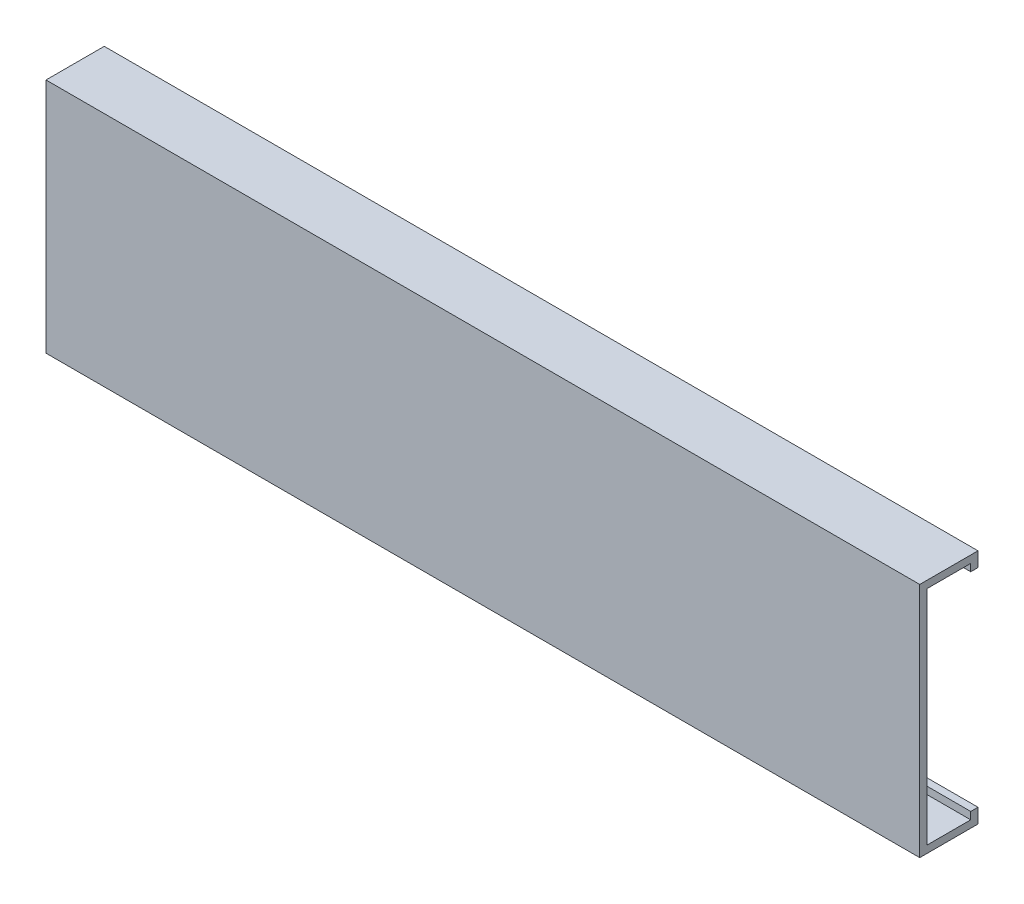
SolidWorks part; units mm, degrees
ref_plane "Front Plane" through (0, 0, 0) normal (0, 0, 1) x (1, 0, 0)
ref_plane "Top Plane" through (0, 0, 0) normal (0, 1, 0) x (1, 0, 0)
ref_plane "Right Plane" through (0, 0, 0) normal (1, 0, 0) x (0, 0, -1)
sketch "Sketch1" plane through (0, 0, 0) normal (0, 0, 1) x (1, 0, 0)
  line L1 (-60, -15.75) -> (60, -15.75)
  line L2 (-60, -15.75) -> (-60, 15.75)
  line L3 (-60, 15.75) -> (60, 15.75)
  line L4 (60, -15.75) -> (60, 15.75)
  line L5 (-60, -15.75) -> (60, 15.75) construction
  line L6 (-60, 15.75) -> (60, -15.75) construction
  point P0 (0, 0)
  dimension "D1" = 31.5
  dimension "D2" = 120
extrude "Boss-Extrude1" add sketch "Sketch1" along normal blind 1
sketch "Sketch2" plane through (0, 15.75, 0) normal (0, 1, 0) x (1, 0, 0)
  line L0 (60, -1) -> (-60, -1) construction
  line L1 (-60, 0) -> (60, 0)
  line L2 (-60, 0) -> (-60, 7)
  line L3 (-60, 7) -> (60, 7)
  line L4 (60, 0) -> (60, 7)
  line L5 (60, -1) -> (60, 0) construction
  dimension "D1" = 7
  dimension "D2" = 0
extrude "Boss-Extrude2" add sketch "Sketch2" against normal blind 1
sketch "Sketch3" plane through (0, 14.75, 0) normal (0, -1, 0) x (1, 0, 0)
  line L0 (60, 0) -> (60, -7) construction
  line L1 (-60, -7) -> (60, -7)
  line L2 (-60, -7) -> (-60, -6)
  line L3 (-60, -6) -> (60, -6)
  line L4 (60, -7) -> (60, -6)
  dimension "D1" = 1
extrude "Boss-Extrude3" add sketch "Sketch3" along normal blind 1
sketch "Sketch4" plane through (0, -15.75, 0) normal (0, -1, 0) x (1, 0, 0)
  line L1 (-60, 1) -> (60, 1)
  line L2 (-60, 1) -> (-60, -7)
  line L3 (-60, -7) -> (60, -7)
  line L4 (60, 1) -> (60, -7)
  line L8 (60, 1) -> (60, 0) construction
  dimension "D1" = 8
extrude "Boss-Extrude4" add sketch "Sketch4" along normal blind 1
sketch "Sketch6" plane through (0, -15.75, 0) normal (0, 1, 0) x (1, 0, 0)
  line L0 (60, 7) -> (60, 0) construction
  line L1 (-60, 7) -> (60, 7)
  line L2 (-60, 7) -> (-60, 6)
  line L3 (-60, 6) -> (60, 6)
  line L4 (60, 7) -> (60, 6)
  dimension "D1" = 1
extrude "Boss-Extrude5" add sketch "Sketch6" along normal blind 1
